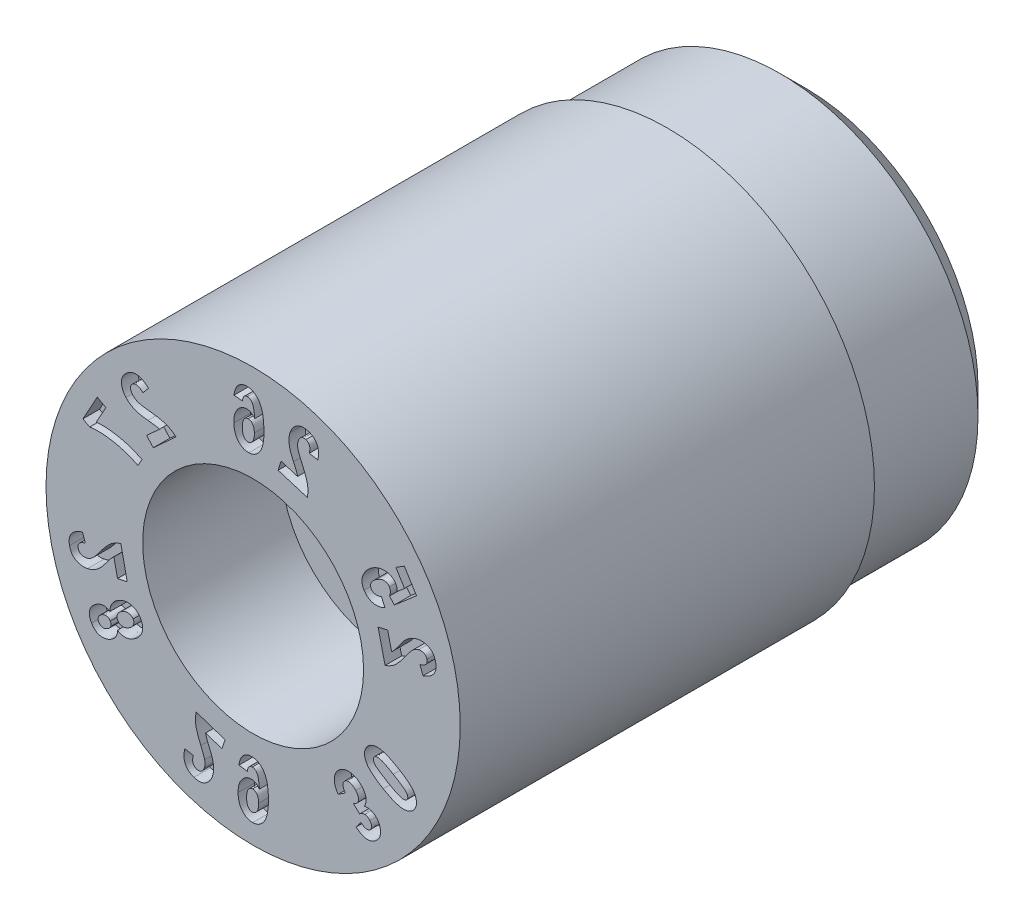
SolidWorks part; units mm, degrees
ref_plane "Front Plane" through (0, 0, 0) normal (0, 0, 1) x (1, 0, 0)
ref_plane "Top Plane" through (0, 0, 0) normal (0, 1, 0) x (1, 0, 0)
ref_plane "Right Plane" through (0, 0, 0) normal (1, 0, 0) x (0, 0, -1)
sketch "Sketch1" plane through (0, 0, 0) normal (1, 0, 0) x (0, 0, -1)
  line L2 (0, 1.5) -> (0, 0.8)
  line L3 (3.75, 1.5) -> (0, 1.5)
  line L4 (-3.7979, 0) -> (49996.2021, 0) construction
  line L8 (4, 0.5) -> (1, 0.5)
  line L9 (1, 0.8) -> (1, 0.5)
  line L10 (1, 0.8) -> (0, 0.8)
  line L12 (4, 0.5) -> (4, 1.25)
  line L16 (4, 1.25) -> (3.75, 1.5)
  dimension "D1" = 4
  dimension "D2" = 45
  dimension "D3" = 0.25
  dimension "D4" = 3
  dimension "D5" = 1.6
  dimension "D6" = 1
  dimension "D7" = 1
revolve "Revolve1" add sketch "Sketch1" angle 360 about L4
sketch "Sketch5" plane through (0, 0, 0) normal (1, 0, 0) x (0, 0, -1)
  line L0 (0, 0) -> (50000, 0) construction
  line L1 (0, 1.5) -> (0, -1.5) construction
  line L2 (3, 1.435) -> (4, 1.435)
  line L3 (3, 1.435) -> (3, 2.435)
  line L4 (3, 2.435) -> (4, 2.435)
  line L5 (4, 1.435) -> (4, 2.435)
  line L6 (4, -1.25) -> (4, 1.25) construction
  line L7 (3.75, 1.5) -> (0, 1.5) construction
  dimension "D1" = 3
  dimension "D2" = 0.065
  dimension "D3" = 1
revolve "Cut-Revolve1" cut sketch "Sketch5" angle 360 about L0
sketch "Sketch12" plane through (0, 0, 0) normal (0, 0, 1) x (1, 0, 0)
  arc A0 (0.9586, 0.0955) -> (0.9603, -0.077) centre (0, 0) ccw construction
  text T0 "25  26  27  28  29  30" font "Arial Narrow" height 0.4
extrude "Cut-Extrude3" cut sketch "Sketch12" against normal blind 0.12
